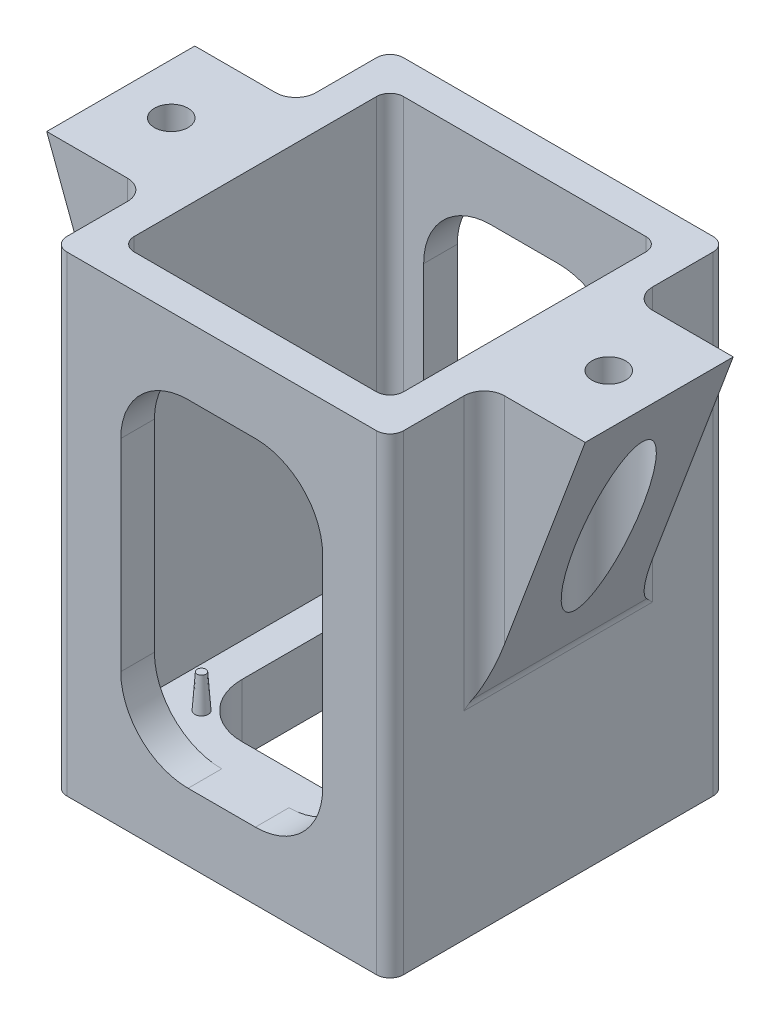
SolidWorks part; units mm, degrees
ref_plane "Plano frontal" through (0, 0, 0) normal (0, 0, 1) x (1, 0, 0)
ref_plane "Plano superior" through (0, 0, 0) normal (0, 1, 0) x (1, 0, 0)
ref_plane "Plano direito" through (0, 0, 0) normal (1, 0, 0) x (0, 0, -1)
sketch "Esboço1" plane through (0, 0, 0) normal (0, 1, 0) x (1, 0, 0)
  line L1 (-25, -25) -> (25, -25)
  line L2 (-25, -25) -> (-25, 25)
  line L3 (-25, 25) -> (25, 25)
  line L4 (25, -25) -> (25, 25)
  line L5 (-25, -25) -> (25, 25) construction
  line L6 (-25, 25) -> (25, -25) construction
  point P0 (0, 0)
  dimension "D1" = 50
  dimension "D2" = 50
extrude "Ressalto-extrusão1" add sketch "Esboço1" along normal blind 70
sketch "Esboço2" plane through (0, 70, 0) normal (0, 1, 0) x (1, 0, 0)
  line L0 (-25, -25) -> (25, -25) construction
  line L1 (25, -25) -> (25, 25) construction
  line L2 (25, 25) -> (-25, 25) construction
  line L3 (-25, 25) -> (-25, -25) construction
  line L4 (-25, -25) -> (25, -25) construction
  line L5 (25, -25) -> (25, 25) construction
  line L6 (25, 25) -> (-25, 25) construction
  line L7 (-25, 25) -> (-25, -25) construction
  line L8 (-20, -20) -> (20, -20)
  line L9 (20, -20) -> (20, 20)
  line L10 (20, 20) -> (-20, 20)
  line L11 (-20, 20) -> (-20, -20)
  dimension "D1" = 5
extrude "Corte-extrusão2" cut sketch "Esboço2" along direction (0, -1, 0) on the side against the normal offset from surface (60 mm away) 10 contours L8 L9 L10 L11
sketch "Esboço3" plane through (0, 10, 0) normal (0, 1, 0) x (1, 0, 0)
  line L0 (7, 15) -> (-7, 15)
  line L1 (-15, 7) -> (-15, -7)
  line L2 (-7, -15) -> (7, -15)
  line L3 (15, -7) -> (15, 7)
  line L4 (-20, 20) -> (-20, -20)
  line L5 (-20, -20) -> (20, -20)
  line L6 (20, -20) -> (20, 20)
  line L7 (20, 20) -> (-20, 20)
  line L8 (-20, 20) -> (-20, -20) construction
  line L9 (-20, -20) -> (20, -20) construction
  line L10 (20, -20) -> (20, 20) construction
  line L11 (20, 20) -> (-20, 20) construction
  line L12 (-15, 15) -> (-15, -15) construction
  line L13 (-15, -15) -> (15, -15) construction
  line L14 (15, -15) -> (15, 15) construction
  line L15 (15, 15) -> (-15, 15) construction
  arc A0 (-15, -7) -> (-7, -15) centre (-7, -7) ccw
  arc A1 (7, -15) -> (15, -7) centre (7, -7) ccw
  arc A2 (7, 15) -> (15, 7) centre (7, 7) cw
  arc A3 (-7, 15) -> (-15, 7) centre (-7, 7) ccw
  dimension "D3" = 8
  dimension "D1" = 0
  dimension "D2" = 5
extrude "Corte-extrusão4" cut sketch "Esboço3" against normal up to surface (10 mm away)
sketch "Esboço4" plane through (0, 10, 0) normal (0, 1, 0) x (1, 0, 0)
  line L0 (0, 0) -> (0, 29.6767) construction
  circle A0 centre (-14, 14) radius 1
  circle A1 centre (14, 14) radius 1
  circle A2 centre (14, -14) radius 1
  circle A3 centre (-14, -14) radius 1
  point P14 (0, 0)
  dimension "D1" = 2
  dimension "D3" = 14
  dimension "D5" = 14
  dimension "D6" = 14
  dimension "D2" = 14
  dimension "D4" = 4
extrude "Ressalto-extrusão2" add sketch "Esboço4" along normal blind 5 draft 4
sketch "Esboço5" plane through (0, 0, 0) normal (0, 0, 1) x (1, 0, 0)
  line L0 (25, 70) -> (25, 0) construction
  line L1 (25, 70) -> (25, 30)
  line L2 (25, 70) -> (40, 70)
  line L3 (40, 70) -> (25, 30)
  line L4 (25, 70) -> (25, 0) construction
  point P2 (0, 0)
  point P5 (25, 32.0374)
  point P6 (0, 0)
  point P8 (0, 0)
  point P9 (0, 0)
  point P10 (0, 0)
  point P11 (25, 44.8529)
  dimension "D1" = 15
  dimension "D2" = 40
extrude "Ressalto-extrusão3" add sketch "Esboço5" along normal mid plane 22
sketch "Esboço6" plane through (0, 70, 0) normal (0, 1, 0) x (1, 0, 0)
  line L0 (0, 0) -> (47.7743, 0) construction
  line L1 (40, 11) -> (25, 11) construction
  line L2 (40, 11) -> (25, 11) construction
  line L3 (32.5, 11) -> (32.5, -11) construction
  line L4 (40, -11) -> (25, -11) construction
  circle A0 centre (32.5, 0) radius 2.5
  point P5 (28.658, 0)
  point P6 (32.5, 0)
  dimension "D1" = 5
extrude "Corte-extrusão5" cut sketch "Esboço6" against normal through all
sketch "Esboço7" plane through (0, 70, 0) normal (0, 1, 0) x (1, 0, 0)
  circle A0 centre (32.5, 0) radius 2.5 construction
  circle A1 centre (32.5, 0) radius 2.5 construction
  circle A2 centre (32.5, 0) radius 5
  dimension "D1" = 10
extrude "Corte-extrusão8" cut sketch "Esboço7" against normal through all from offset 4
mirror "Espelhar5" about plane through (0, 0, 0) normal (1, 0, 0) of "Corte-extrusão8", "Corte-extrusão5", "Ressalto-extrusão3"
fillet "Filete1" radius 3 5 edges at (25, 50, -11) (25, 30, 0) (25, 50, 11) (-25, 50, -11) (-25, 50, 11)
sketch "Esboço8" plane through (0, 0, -25) normal (0, 0, -1) x (-1, 0, 0)
  line L9 (-5, 10) -> (5, 10)
  line L10 (15, 20) -> (15, 50)
  line L11 (5, 60) -> (-5, 60)
  line L12 (-15, 50) -> (-15, 20)
  line L13 (-25, 0) -> (25, 0)
  line L14 (25, 0) -> (25, 70)
  line L15 (25, 70) -> (-25, 70)
  line L16 (-25, 70) -> (-25, 0)
  line L17 (-25, 0) -> (25, 0) construction
  line L18 (25, 0) -> (25, 70) construction
  line L19 (25, 70) -> (-25, 70) construction
  line L20 (-25, 70) -> (-25, 0) construction
  line L21 (-15, 10) -> (15, 10) construction
  line L22 (-15, 60) -> (-15, 10) construction
  line L23 (15, 10) -> (15, 60) construction
  line L24 (15, 60) -> (-15, 60) construction
  arc A0 (-5, 10) -> (-15, 20) centre (-5, 20) cw
  arc A1 (5, 10) -> (15, 20) centre (5, 20) ccw
  arc A2 (15, 50) -> (5, 60) centre (5, 50) ccw
  arc A3 (-5, 60) -> (-15, 50) centre (-5, 50) ccw
  dimension "D3" = 10
  dimension "D1" = 0
  dimension "D2" = 10
extrude "Corte-extrusão9" cut sketch "Esboço8" against normal up to next
mirror "Espelhar8" about plane through (0, 0, 0) normal (0, 0, 1) of "Corte-extrusão9"
fillet "Filete2" radius 2 8 edges at (25, 35, 25) (-25, 35, 25) (-25, 35, -25) (25, 35, -25) (-20, 40, -20) (-20, 40, 20) (20, 40, -20) (20, 40, 20)
